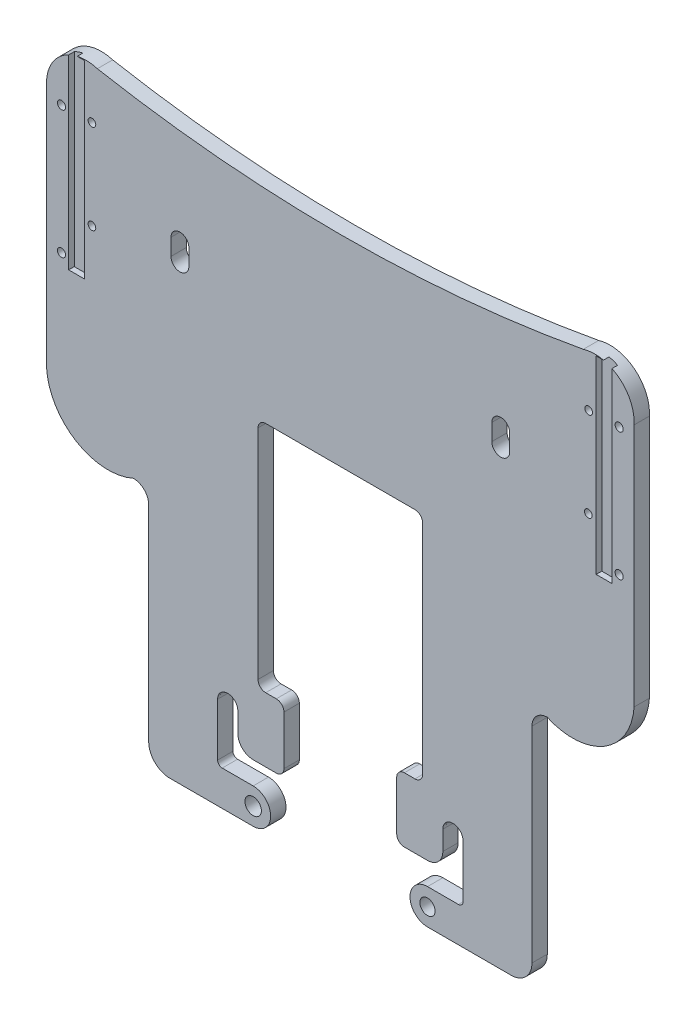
SolidWorks part; units mm, degrees
ref_plane "Front Plane" through (0, 0, 0) normal (0, 0, 1) x (1, 0, 0)
ref_plane "Top Plane" through (0, 0, 0) normal (0, 1, 0) x (1, 0, 0)
ref_plane "Right Plane" through (0, 0, 0) normal (1, 0, 0) x (0, 0, -1)
sketch "Model" plane through (0, 0, 0) normal (0, 0, 1) x (1, 0, 0)
  line L0 (198.0554, 367.8756) -> (198.0554, 147.7838) construction
  line L1 (131.8295, 228.9849) -> (163.9703, 228.9849)
  line L2 (163.9703, 242.6672) -> (151.8679, 242.6672)
  line L3 (246.043, 265.0984) -> (246.043, 244.4672)
  line L4 (157.9703, 265.1019) -> (157.9703, 257.525)
  line L5 (150.0679, 265.0984) -> (150.0679, 244.4672)
  line L6 (220.099, 273.6884) -> (220.099, 254.525)
  line L7 (230.237, 279.6884) -> (230.237, 364.8756)
  line L9 (223.099, 276.6884) -> (227.237, 276.6884)
  line L10 (272.9904, 317.4271) -> (272.9904, 237.2092)
  line L11 (232.1405, 242.6672) -> (244.243, 242.6672)
  line L12 (264.2813, 228.9849) -> (232.1405, 228.9849)
  line L16 (83.1839, 439.397) -> (83.1839, 343.8806)
  line L19 (232.1405, 251.525) -> (223.099, 251.525)
  line L20 (163.9703, 251.525) -> (173.0118, 251.525)
  line L21 (173.0118, 276.6884) -> (168.8739, 276.6884)
  line L22 (123.1204, 317.4271) -> (123.1204, 237.2092)
  line L23 (165.8739, 279.6884) -> (165.8739, 364.8756)
  line L24 (246.043, 265.0984) -> (246.043, 242.6672)
  line L28 (-7.4087, 367.7867) -> (403.5195, 367.7867) construction
  line L29 (168.8739, 367.8756) -> (227.237, 367.8756)
  line L30 (176.0118, 273.6884) -> (176.0118, 254.525)
  line L32 (238.1405, 265.1019) -> (238.1405, 257.525)
  line L34 (135.3295, 412.4166) -> (135.3295, 405.9294) construction
  line L35 (138.8295, 412.4166) -> (138.8295, 405.9294)
  line L36 (131.8295, 412.4166) -> (131.8295, 405.9294)
  line L37 (312.9269, 439.397) -> (312.9269, 343.8806)
  line L43 (260.7813, 412.4166) -> (260.7813, 405.9294) construction
  line L44 (257.2813, 412.4166) -> (257.2813, 405.9294)
  line L45 (264.2813, 412.4166) -> (264.2813, 405.9294)
  line L54 (254.8597, 211.4359) -> (254.8597, 245.7191) construction
  arc A0 (123.1204, 237.2092) -> (131.8295, 228.9849) centre (131.3583, 237.2092) ccw
  arc A1 (163.9703, 228.9849) -> (163.9703, 242.6672) centre (163.9703, 235.826) ccw
  arc A2 (151.8679, 242.6672) -> (150.0679, 244.4672) centre (151.8679, 244.4672) cw
  arc A3 (244.243, 242.6672) -> (246.043, 244.4672) centre (244.243, 244.4672) ccw
  circle A4 centre (163.9703, 235.826) radius 3.2192
  circle A5 centre (232.1405, 235.826) radius 2.9839
  arc A6 (232.1405, 228.9849) -> (232.1405, 242.6672) centre (232.1405, 235.826) cw
  arc A7 (272.9904, 237.2092) -> (264.2813, 228.9849) centre (264.7526, 237.2092) cw
  arc A16 (165.8739, 279.6884) -> (168.8739, 276.6884) centre (168.8739, 279.6884) ccw
  arc A17 (165.8739, 364.8756) -> (168.8739, 367.8756) centre (168.8739, 364.8756) cw
  arc A18 (163.9703, 251.525) -> (157.9703, 257.525) centre (163.9703, 257.525) cw
  arc A19 (176.0118, 254.525) -> (173.0118, 251.525) centre (173.0118, 254.525) cw
  arc A20 (176.0118, 273.6884) -> (173.0118, 276.6884) centre (173.0118, 273.6884) ccw
  arc A21 (117.1204, 323.4271) -> (123.1204, 317.4271) centre (117.1204, 317.4271) cw
  arc A24 (138.8295, 412.4166) -> (131.8295, 412.4166) centre (135.3295, 412.4166) ccw
  arc A25 (131.8295, 405.9294) -> (138.8295, 405.9294) centre (135.3295, 405.9294) ccw
  arc A33 (103.0401, 455.0847) -> (293.0707, 455.0847) centre (198.0554, 973.9201) ccw
  arc A34 (278.9904, 323.4271) -> (272.9904, 317.4271) centre (278.9904, 317.4271) ccw
  arc A35 (220.099, 273.6884) -> (223.099, 276.6884) centre (223.099, 273.6884) cw
  arc A36 (220.099, 254.525) -> (223.099, 251.525) centre (223.099, 254.525) ccw
  arc A38 (230.237, 364.8756) -> (227.237, 367.8756) centre (227.237, 364.8756) ccw
  arc A39 (230.237, 279.6884) -> (227.237, 276.6884) centre (227.237, 279.6884) cw
  arc A54 (257.2813, 412.4166) -> (264.2813, 412.4166) centre (260.7813, 412.4166) cw
  arc A55 (264.2813, 405.9294) -> (257.2813, 405.9294) centre (260.7813, 405.9294) cw
  arc A56 (232.1405, 251.525) -> (238.1405, 257.525) centre (232.1405, 257.525) ccw
  arc A74 (83.1839, 439.397) -> (103.0401, 455.0847) centre (98.5855, 440.313) cw
  arc A75 (312.9269, 439.397) -> (293.0707, 455.0847) centre (297.5254, 440.313) ccw
  arc A81 (83.1839, 343.8806) -> (117.1204, 323.4271) centre (107.2428, 345.4186) ccw
  arc A82 (312.9269, 343.8806) -> (278.9904, 323.4271) centre (288.868, 345.4186) cw
  spline S5 degree 3 poles (242.09, 269.0515) (239.9087, 269.0515) (238.1405, 267.283) (238.1405, 265.1019) knots 12 12 12 12 13 13 13 13
  spline S6 degree 3 poles (246.043, 265.0984) (246.043, 267.2814) (244.2732, 269.0515) (242.09, 269.0515) knots 11 11 11 11 12 12 12 12
  spline S40 degree 3 poles (150.0679, 265.0984) (150.0679, 267.2814) (151.8376, 269.0515) (154.0208, 269.0515) knots 11 11 11 11 12 12 12 12
  spline S41 degree 3 poles (154.0208, 269.0515) (156.2021, 269.0515) (157.9703, 267.283) (157.9703, 265.1019) knots 12 12 12 12 13 13 13 13
  point P24 (198.0554, 367.7867)
  point P133 (135.3295, 409.173)
  point P177 (198.0554, 367.8756)
  point P182 (260.7813, 409.173)
  dimension "D10" = 3
  dimension "D2" = 6
  dimension "D3" = 6
  dimension "D5" = 26.9475
  dimension "D4" = 1.8
  dimension "D6" = 6.8412
extrude "Boss-Extrude1" add sketch "Model" along normal blind 6
sketch "Sketch1" plane through (0, 0, 6) normal (0, 0, 1) x (1, 0, 0)
  line L0 (198.0554, 367.8756) -> (198.0554, 446.4562) construction
  line L1 (168.8739, 367.8756) -> (227.237, 367.8756) construction
  arc A0 (103.0401, 455.0847) -> (293.0707, 455.0847) centre (198.0554, 973.9201) ccw construction
sketch "Sketch3" plane through (0, 0, 0) normal (0, 0, -1) x (-1, 0, 0)
  line L0 (-198.0554, 446.4562) -> (-198.0554, 367.8756) construction
  line L1 (-89.0207, 435.7817) -> (-89.0207, 385.7817) construction
  line L2 (-307.0901, 435.7817) -> (-307.0901, 385.7817) construction
  circle A0 centre (-89.0207, 435.7817) radius 1.6
  circle A1 centre (-89.0207, 385.7817) radius 1.6
  circle A2 centre (-307.0901, 385.7817) radius 1.6
  circle A3 centre (-307.0901, 435.7817) radius 1.6
  dimension "D1" = 3.2
  dimension "D2" = 3.2
  dimension "D3" = 50
extrude "Cut-Extrude1" cut sketch "Sketch3" against normal blind 6
sketch "Sketch4" plane through (0, 0, 6) normal (0, 0, 1) x (1, 0, 0)
  circle A0 centre (295.0277, 400.4379) radius 1.5
  circle A1 centre (295.1517, 435.4376) radius 1.5
  circle A2 centre (100.9207, 435.7817) radius 1.5
  circle A3 centre (100.9207, 400.7817) radius 1.5
extrude "Cut-Extrude2" cut sketch "Sketch4" against normal blind 6
sketch "Sketch5" plane through (0, 0, 6) normal (0, 0, 1) x (1, 0, 0)
  line L0 (98.0207, 381.3584) -> (91.8207, 381.3584)
  line L1 (91.8207, 381.3584) -> (91.8207, 455.3584)
  line L2 (91.8207, 455.3584) -> (98.0207, 455.3584)
  line L3 (98.0207, 455.3584) -> (98.0207, 381.3584)
  line L4 (198.0554, 446.4562) -> (198.0554, 367.8756) construction
  line L5 (168.8739, 367.8756) -> (227.237, 367.8756) construction
  line L6 (298.0901, 455.3584) -> (298.0901, 381.3584)
  line L7 (304.2901, 455.3584) -> (298.0901, 455.3584)
  line L8 (304.2901, 381.3584) -> (304.2901, 455.3584)
  line L9 (298.0901, 381.3584) -> (304.2901, 381.3584)
extrude "Cut-Extrude3" cut sketch "Sketch5" against normal blind 2.2
